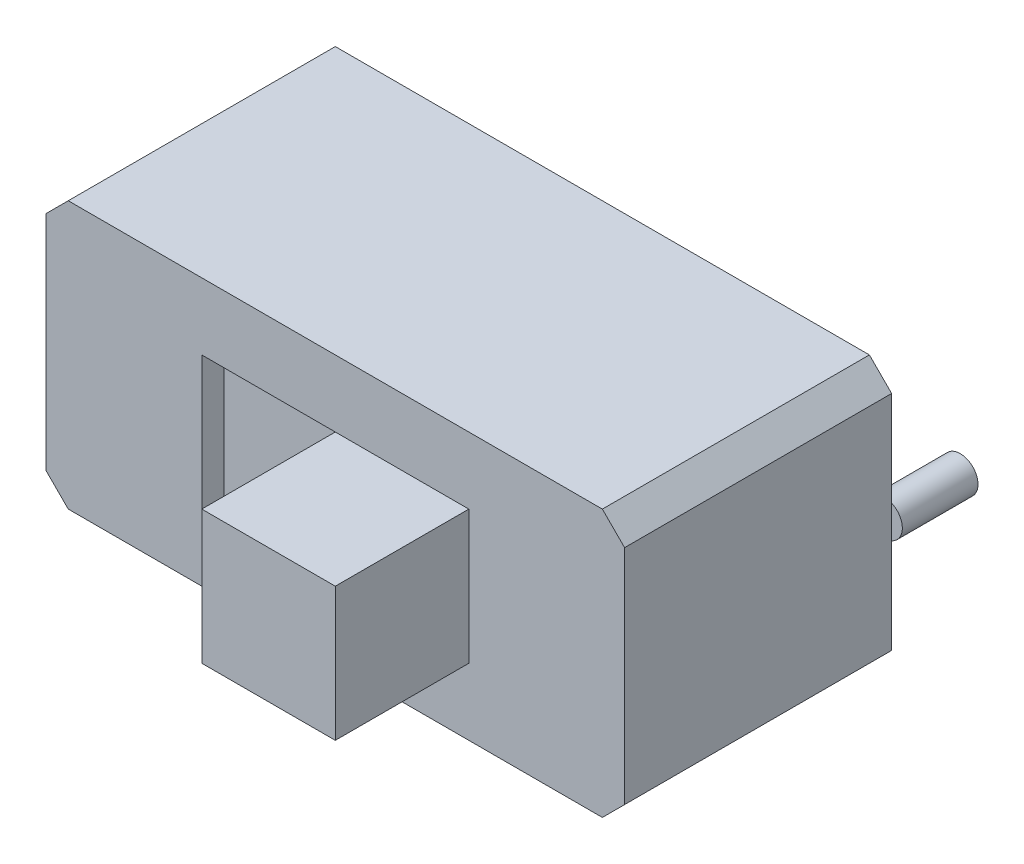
SolidWorks part; units mm, degrees
ref_plane "Face" through (0, 0, 0) normal (0, 0, 1) x (1, 0, 0)
ref_plane "Dessus" through (0, 0, 0) normal (0, 1, 0) x (1, 0, 0)
ref_plane "Droite" through (0, 0, 0) normal (1, 0, 0) x (0, 0, -1)
sketch "Esquisse1" plane through (0, 0, 0) normal (0, 0, 1) x (1, 0, 0)
  line L0 (-7.1819, 0) -> (16.0223, 0) construction
  line L1 (0, -4.7508) -> (0, 20.0598) construction
  line L2 (6.5, -2.5) -> (6.5, 2.5)
  line L3 (6, 3) -> (-6, 3)
  line L4 (6.5, 2.5) -> (6, 3)
  line L5 (6.5, -2.5) -> (6, -3)
  line L6 (6, -3) -> (-6, -3)
  line L7 (-6.5, -2.5) -> (-6, -3)
  line L8 (-6.5, 2.5) -> (-6, 3)
  line L9 (-6.5, -2.5) -> (-6.5, 2.5)
  point P4 (6.5, -3)
  point P6 (6.5, 3)
  point P7 (-6.5, 0)
  point P13 (6.5, 0)
  point P15 (0, -3)
  point P18 (0, 3)
  point P19 (-6.5, 3)
  point P20 (-6.5, -3)
  dimension "D1" = 13
  dimension "D2" = 6
extrude "Extrusion1" add sketch "Esquisse1" along normal blind 6
sketch "Esquisse2" plane through (0, 0, 6) normal (0, 0, 1) x (1, 0, 0)
  line L0 (0, 0) -> (3.7628, 0) construction
  line L1 (0, -1.5) -> (3, -1.5)
  line L2 (0, -1.5) -> (0, 1.5)
  line L3 (0, 1.5) -> (3, 1.5)
  line L4 (3, 1.5) -> (3, -1.5)
  dimension "D1" = 3
  dimension "D2" = 3
extrude "Extrusion2" add sketch "Esquisse2" along normal blind 3
sketch "Esquisse3" plane through (0, 0, 6) normal (0, 0, 1) x (1, 0, 0)
  line L0 (0, 1.5) -> (0, -2.0028) construction
  line L1 (0, 1.5) -> (3, 1.5) construction
  line L2 (0, -1.5) -> (-3, -1.5)
  line L3 (0, -1.5) -> (0, 1.5)
  line L4 (0, 1.5) -> (-3, 1.5)
  line L5 (-3, -1.5) -> (-3, 1.5)
  line L6 (0, -1.5) -> (3, -1.5) construction
  dimension "D1" = 3
extrude "Enlèv. mat.-Extru.1" cut sketch "Esquisse3" against normal blind 0.5
sketch "Esquisse4" plane through (0, 0, 0) normal (0, 0, -1) x (-1, 0, 0)
  line L0 (-7.1965, 0) -> (3.8853, 0) construction
  line L1 (0, -4.3678) -> (0, 0.7904) construction
  circle A0 centre (0, 0) radius 0.4
  circle A1 centre (3.17, 0) radius 0.4
  circle A2 centre (6.34, 0) radius 0.4
  circle A3 centre (-3.17, 0) radius 0.4
  circle A4 centre (-6.34, 0) radius 0.4
  dimension "D1" = 3
extrude "Boss.-Extru.1" add sketch "Esquisse4" along normal blind 1.7
